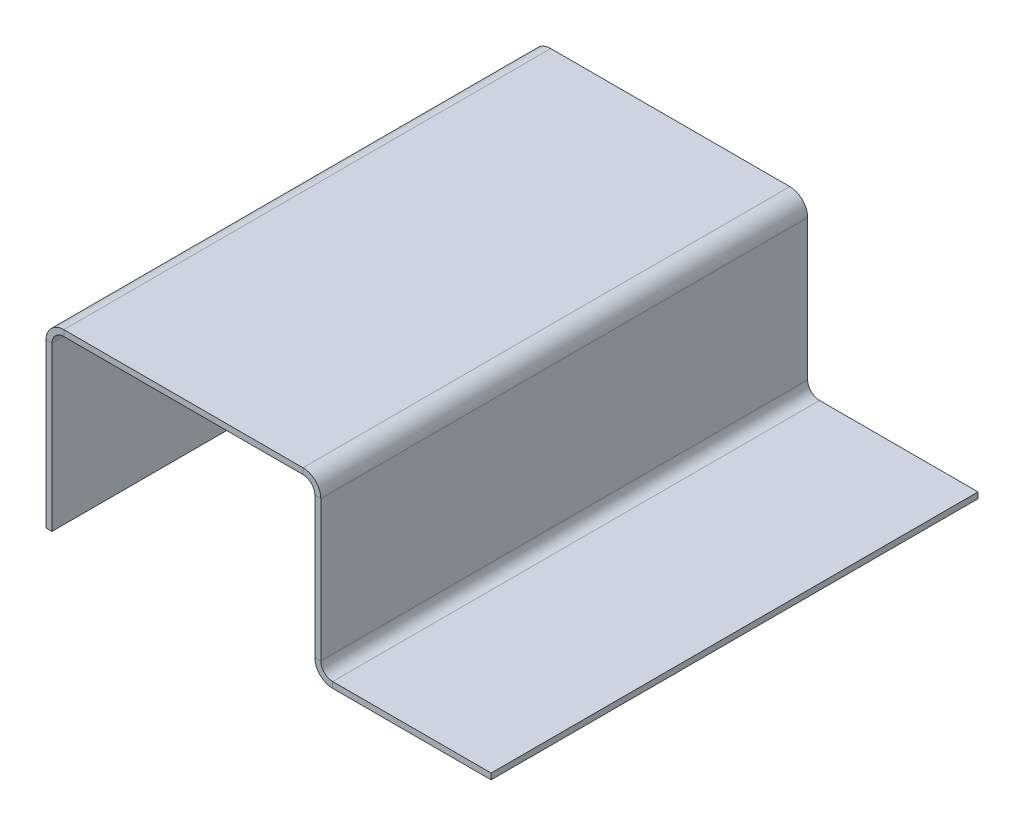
SolidWorks part; units mm, degrees
ref_plane "Front" through (0, 0, 0) normal (0, 0, 1) x (1, 0, 0)
ref_plane "Top" through (0, 0, 0) normal (0, 1, 0) x (1, 0, 0)
ref_plane "Right" through (0, 0, 0) normal (1, 0, 0) x (0, 0, -1)
sketch "Sketch1" plane through (0, 0, 0) normal (0, 0, 1) x (1, 0, 0)
  line L0 (0, 0) -> (0, 30.4317)
  line L1 (0, 30.4317) -> (46.2766, 30.4317)
  line L2 (46.2766, 30.4317) -> (46.2766, 1.7472)
  line L3 (46.2766, 1.7472) -> (74.9611, 1.7472)
extrude "Extrude-Thin1" add sketch "Sketch1" along normal mid plane 82 thin
sheet metal parameters "Sheet-Metal2" parameters "D1"=2
bend "SharpBend6" bend angle 90 parameters "D1"=0, "D5"=1
flatten bends "Flatten-Bends2" parameters "D1"=0
sketch "Sharp-Sketch2" plane through (0, 1.7472, 0) normal (0, 1, 0) x (-1, 0, 0)
  line L0 (-45.9204, -41) -> (-45.9204, 41) construction
  line L1 (-17.5236, 41) -> (-17.5236, -41) construction
  line L2 (27.4655, 41) -> (27.4655, -41) construction
bend "SharpBend4" bend angle 90 parameters "D1"=0, "D5"=2
bend "SharpBend5" bend angle 90 parameters "D1"=0, "D5"=3
process bends "Process-Bends2" parameters "D1"=0
sketch "Flat-Sketch2" plane through (0, 1.7472, 0) normal (0, 1, 0) x (-1, 0, 0)
